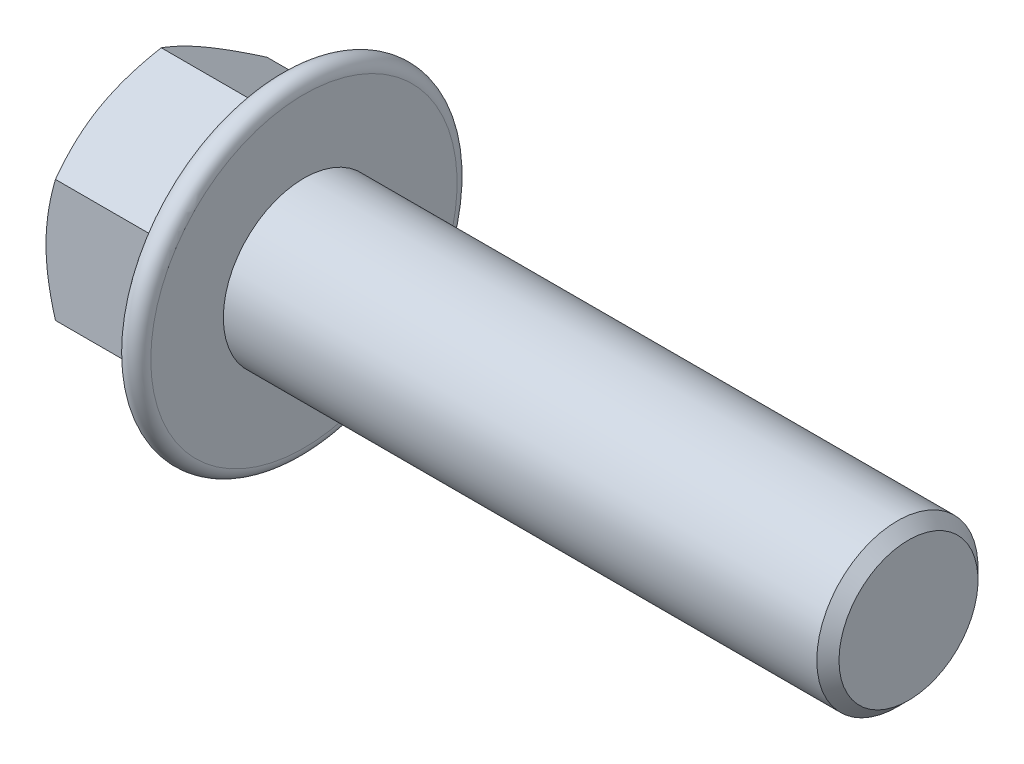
SolidWorks part; units mm, degrees
ref_plane "Plane1" through (0, 0, 0) normal (0, 0, 1) x (1, 0, 0)
ref_plane "Plane2" through (0, 0, 0) normal (0, 1, 0) x (1, 0, 0)
ref_plane "Plane3" through (0, 0, 0) normal (1, 0, 0) x (0, 0, -1)
sketch "Sketch1" plane through (0, 0, 0) normal (1, 0, 0) x (0, 0, -1)
  line L0 (10.5, 6.0622) -> (10.5, -6.0622)
  line L1 (-10.5, 6.0622) -> (-10.5, -6.0622)
  line L2 (10.5, -6.0622) -> (0, -12.1244)
  line L3 (0, -12.1244) -> (-10.5, -6.0622)
  line L4 (10.5, 6.0622) -> (0, 12.1244)
  line L5 (0, 12.1244) -> (-10.5, 6.0622)
  dimension "Width_flats" = 21
  dimension "D2" = 120
  dimension "D3" = 10.5
  dimension "D4" = 10.5
  dimension "D5" = 10.5
extrude "BaseHead" add sketch "Sketch1" along normal blind 15.1
sketch "BodySke" plane through (0, 0, 0) normal (0, 0, 1) x (1, 0, 0)
  line L0 (0, 6.0622) -> (0, -6.0622) construction
  line L1 (0, 0) -> (75.1, 0)
  line L2 (0, 0) -> (0, 8)
  line L3 (0, 8) -> (73.9985, 8)
  line L4 (75.1, 0) -> (75.1, 6.8985)
  line L5 (15.1, 12.1244) -> (15.1, 6.0622) construction
  line L6 (75.1, 6.8985) -> (73.9985, 8)
  line L7 (0, 0) -> (96.52, 0) construction
  line L8 (75.1, -6.8985) -> (73.9985, -8) construction
  line L9 (0, -8) -> (73.9985, -8) construction
  line L10 (17.1, 15.24) -> (17.1, -1.27) construction
  line L11 (37.1, 15.24) -> (37.1, -1.27) construction
  line L12 (15.1, 6.0622) -> (15.1, -6.0622) construction
  dimension "Length" = 60
  dimension "Body_ch_ang" = 45
  dimension "Diameter" = 16
  dimension "Minor_dia" = 13.797
  dimension "Advance" = 2
  dimension "Thread_nom" = 38
revolve "BaseBody" add sketch "BodySke"
fillet "HeadFillet" [suppressed] radius 0.8
sketch "Sketch3" plane through (0, 0, 0) normal (0, 0, 1) x (1, 0, 0)
  line L0 (0, 10.5) -> (3.8246, 17.1244)
  line L1 (0, 12.1244) -> (0, 6.0622) construction
  line L2 (3.8246, 17.1244) -> (3.8246, 22.1244)
  line L3 (3.8246, 22.1244) -> (-10, 22.1244)
  line L4 (-10, 22.1244) -> (-10, 10.5)
  line L5 (-10, 10.5) -> (0, 10.5)
  line L6 (0, 0) -> (99.06, 0) construction
  line L7 (15.1, 12.1244) -> (0, 12.1244) construction
  dimension "D1" = 10.5
  dimension "D2" = 5
  dimension "D3" = 10
  dimension "D4" = 5
  dimension "Head_ch_ang" = 30
revolve "HeadChamfer" cut sketch "Sketch3" angle 360 about L6
sketch "Sketch4" plane through (0, 0, 0) normal (0, 0, 1) x (1, 0, 0)
  line L0 (7.0906, 0) -> (12.7724, 15.6104)
  line L1 (15.1, 12.1244) -> (15.1, 6.0622) construction
  line L2 (12.7, 34.3444) -> (12.7, 16.9779) construction
  line L3 (15.1, 0) -> (15.1, 15.2)
  line L4 (8.3021, 16.4) -> (20.1618, 16.4) construction
  line L5 (0, 0) -> (95.25, 0) construction
  line L6 (0, 0) -> (96.52, 0) construction
  line L7 (7.0906, 0) -> (15.1, 0)
  line L8 (8.3021, -16.4) -> (20.1618, -16.4) construction
  arc A0 (15.1, 15.2) -> (12.7724, 15.6104) centre (13.9, 15.2) ccw
  dimension "D1" = 20
  dimension "Flange_thickness" = 2.4
  dimension "Flange_dia" = 32.8
revolve "Flange" add sketch "Sketch4" angle 360 about L5
fillet "FlangeHexFillet" radius 1 6 edges
sketch "ThdSchSke" plane through (0, 0, 0) normal (0, 0, 1) x (1, 0, 0)
  line L0 (37.1, -6.8985) -> (36.3287, -8)
  line L1 (37.1, -6.8985) -> (37.8713, -8)
  line L2 (37.8713, -8) -> (37.8713, -10)
  line L3 (-3.175, 0) -> (5.1513, 0) construction
  line L5 (37.8713, -10) -> (36.3287, -10)
  line L6 (36.3287, -10) -> (36.3287, -8)
  dimension "Thread_minor" = 13.797
  dimension "Diameter" = 16
  dimension "Start" = 37.1
  dimension "SideAngle" = 55
  dimension "VeeAngle" = 70
  dimension "Overcut" = 20
revolve "ThreadSchematic" [suppressed] cut sketch "ThdSchSke" angle 360 about L3
pattern_linear "ThdSchPat" [suppressed]
equation "\"D3@Sketch1\" = \"Width_flats@Sketch1\" / 2"
equation "\"D4@Sketch1\" = \"D3@Sketch1\""
equation "\"D5@Sketch1\" = \"D4@Sketch1\""
equation "\"Thread_minor@ThreadCosmetic\" = \"Minor_dia@BodySke\""
equation "\"D1@Sketch3\" = \"Width_flats@Sketch1\" / 2"
equation "\"Thread_length@ThreadCosmetic\" = ((sgn( (\"Length@BodySke\" - \"Advance@BodySke\" ) - \"Thread_nom@BodySke\" )-1)*( (\"Length@BodySke\" - \"Advance@BodySke\" ) - \"Thread_nom@BodySke\" ))/-2+ \"Thread_nom@BodySke\""
equation "\"Thread_minor@ThdSchSke\" = \"Minor_dia@BodySke\""
equation "\"Diameter@ThdSchSke\" = \"Diameter@BodySke\""
equation "\"Overcut@ThdSchSke\" = \"Diameter@BodySke\" * 1.25"
equation "\"Start@ThdSchSke\" = \"Head_ht@BaseHead\" + \"Length@BodySke\" - \"Thread_length@ThreadCosmetic\"  '---Non-countersunk---"
equation "\"Num_threads@ThdSchPat\" = int( \"Thread_length@ThreadCosmetic\" / \"Advance@BodySke\" + 0.999 )  + 1"
equation "\"Advance@ThdSchPat\" = \"Thread_length@ThreadCosmetic\" /  (\"Num_threads@ThdSchPat\" - 1) 'relax it"
equation "\"Num_threads@ThdSchPat\" = \"Num_threads@ThdSchPat\" - sgn( \"Num_threads@ThdSchPat\" - 1) '---chamfered tips only---"
